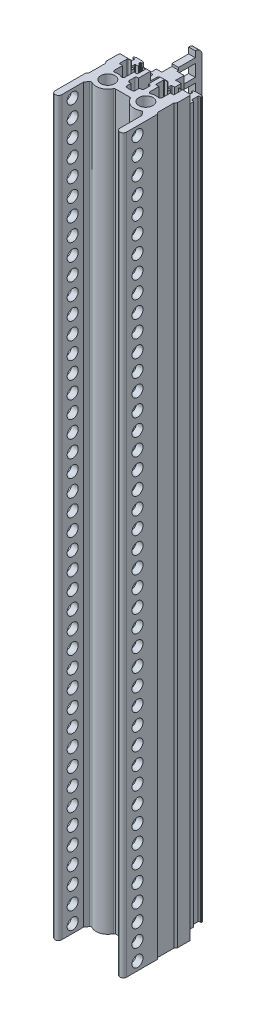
SolidWorks part; units mm, degrees
ref_plane "前视基准面" through (0, 0, 0) normal (0, 0, 1) x (1, 0, 0)
ref_plane "上视基准面" through (0, 0, 0) normal (0, 1, 0) x (1, 0, 0)
ref_plane "右视基准面" through (0, 0, 0) normal (1, 0, 0) x (0, 0, -1)
sketch "草图1" plane through (0, 0, 0) normal (0, 1, 0) x (1, 0, 0)
  line L0 (-2.825, 13.6) -> (-3.725, 13.6)
  line L1 (-8.025, 13.6) -> (-8.025, 11.3)
  line L2 (-3.725, 11.3) -> (-2.825, 11.3)
  line L3 (-3.725, 7.5298) -> (-3.725, 11.3)
  line L4 (-7.125, 11.3) -> (-7.125, 7.8763)
  line L5 (-8.025, 11.3) -> (-7.125, 11.3)
  line L6 (-2.825, 13.6) -> (-2.825, 11.3)
  line L7 (-7.125, 13.6) -> (-8.025, 13.6)
  line L8 (-7.125, 14.6) -> (-7.125, 13.6)
  line L9 (-8.025, 14.6) -> (-7.125, 14.6)
  line L10 (-8.025, 15.8) -> (-8.025, 14.6)
  line L11 (-7.125, 15.8) -> (-8.025, 15.8)
  line L12 (-5.675, 5.25) -> (5.675, 5.25) construction
  line L13 (0, 5.25) -> (0, 10.7319) construction
  line L15 (-10.275, 14.8) -> (-10.275, 13.75)
  line L16 (-9.525, 16.95) -> (-9.525, 15.2)
  line L17 (-10.275, 12.95) -> (-10.375, 12.95) construction
  line L18 (-10.675, 12.65) -> (-10.375, 12.95) construction
  line L19 (-10.675, 9.65) -> (-10.675, 12.65)
  line L20 (-10.2249, 9.1498) -> (-10.675, 9.65)
  line L21 (-10.2249, 9.1498) -> (-10.2251, 4.1498)
  line L22 (-10.675, 3.65) -> (-10.2251, 4.1498)
  line L23 (-10.675, -5.5) -> (-10.675, 3.65)
  line L24 (-8.675, -4.1) -> (-8.675, 0)
  line L25 (-0.675, 20.25) -> (-0.675, 17.75)
  line L26 (-2.075, 20.25) -> (-0.675, 20.25)
  line L27 (-2.075, 17.75) -> (-2.075, 20.25)
  line L28 (-3.725, 17.75) -> (-2.075, 17.75)
  line L29 (-3.725, 15.8) -> (-3.725, 17.75)
  line L30 (-2.825, 15.8) -> (-3.725, 15.8)
  line L31 (-2.825, 14.6) -> (-2.825, 15.8)
  line L32 (-3.725, 14.6) -> (-2.825, 14.6)
  line L33 (-3.725, 13.6) -> (-3.725, 14.6)
  line L34 (-10.675, -5.5) -> (-10.675, 3.65)
  line L35 (-8.675, -5.5) -> (-8.675, 0)
  line L36 (-0.675, 20.25) -> (-0.675, 17.75)
  line L37 (0.675, 20.25) -> (0.675, 17.75)
  line L38 (-2.075, 20.25) -> (-0.675, 20.25)
  line L39 (-2.075, 17.75) -> (-2.075, 20.25)
  line L40 (-3.725, 17.75) -> (-2.075, 17.75)
  line L41 (-3.725, 15.8) -> (-3.725, 17.75)
  line L42 (-2.825, 15.8) -> (-3.725, 15.8)
  line L43 (-2.825, 14.6) -> (-2.825, 15.8)
  line L44 (-3.725, 14.6) -> (-2.825, 14.6)
  line L45 (-3.725, 13.6) -> (-3.725, 14.6)
  line L46 (-2.825, 13.6) -> (-3.725, 13.6)
  line L47 (2.825, 13.6) -> (2.825, 11.3)
  line L48 (-3.725, 11.3) -> (-2.825, 11.3)
  line L49 (-3.725, 7.5298) -> (-3.725, 11.3)
  line L50 (-7.125, 11.3) -> (-7.125, 7.8763)
  line L51 (-8.025, 11.3) -> (-7.125, 11.3)
  line L52 (2.825, 11.3) -> (2.8554, 11.3157)
  line L53 (-7.125, 13.6) -> (-8.025, 13.6)
  line L54 (-7.125, 14.6) -> (-7.125, 13.6)
  line L55 (-8.025, 14.6) -> (-7.125, 14.6)
  line L56 (-8.025, 15.8) -> (-8.025, 14.6)
  line L57 (-7.125, 15.8) -> (-8.025, 15.8)
  line L58 (-10.275, 13.75) -> (-10.375, 13.75)
  line L59 (-9.725, 15) -> (-10.075, 15)
  line L60 (-7.875, 17.75) -> (-9.675, 17.75)
  line L61 (-9.675, 17.75) -> (-9.7164, 17.7086)
  line L62 (-10.225, 17.45) -> (-10.225, 17.35)
  line L63 (-10.275, 12.95) -> (-10.375, 12.95) construction
  line L64 (-10.675, 12.65) -> (-10.375, 12.95) construction
  line L65 (-10.675, 9.65) -> (-10.675, 12.65)
  line L66 (-10.2249, 9.1498) -> (-10.675, 9.65)
  line L67 (-10.2249, 9.1498) -> (-10.2251, 4.1498)
  line L68 (-10.2251, 4.1498) -> (-10.2251, 6.4588)
  line L69 (2.825, 13.6) -> (3.725, 13.6)
  line L70 (8.025, 13.6) -> (8.025, 11.3)
  line L71 (3.725, 11.3) -> (2.825, 11.3)
  line L72 (3.725, 7.5298) -> (3.725, 11.3)
  line L73 (7.125, 11.3) -> (7.125, 7.8763)
  line L74 (8.025, 11.3) -> (7.125, 11.3)
  line L75 (-10.025, 17.15) -> (-9.725, 17.15)
  line L76 (7.125, 13.6) -> (8.025, 13.6)
  line L77 (7.125, 14.6) -> (7.125, 13.6)
  line L78 (8.025, 14.6) -> (7.125, 14.6)
  line L79 (8.025, 15.8) -> (8.025, 14.6)
  line L80 (7.125, 15.8) -> (8.025, 15.8)
  line L81 (-9.8578, 17.65) -> (-10.025, 17.65)
  line L82 (-7.8336, 17.7086) -> (-7.875, 17.75)
  line L83 (-7.325, 17.35) -> (-7.325, 17.45)
  line L85 (7.125, 15.8) -> (7.125, 15.8672)
  line L86 (10.275, 12.95) -> (10.375, 12.95) construction
  line L87 (10.675, 12.65) -> (10.375, 12.95) construction
  line L88 (10.675, 9.65) -> (10.675, 12.65)
  line L89 (10.2249, 9.1498) -> (10.675, 9.65)
  line L90 (10.2249, 9.1498) -> (10.2251, 4.1498)
  line L91 (10.675, 3.65) -> (10.2251, 4.1498)
  line L92 (10.675, -5.5) -> (10.675, 3.65)
  line L93 (8.675, -4.1) -> (8.675, 0)
  line L94 (0.675, 20.25) -> (0.675, 17.75)
  line L95 (2.075, 20.25) -> (0.675, 20.25)
  line L96 (2.075, 17.75) -> (2.075, 20.25)
  line L97 (3.725, 17.75) -> (2.075, 17.75)
  line L98 (3.725, 15.8) -> (3.725, 17.75)
  line L99 (2.825, 15.8) -> (3.725, 15.8)
  line L100 (2.825, 14.6) -> (2.825, 15.8)
  line L101 (3.725, 14.6) -> (2.825, 14.6)
  line L102 (3.725, 13.6) -> (3.725, 14.6)
  line L103 (10.675, -5.5) -> (10.675, 3.65)
  line L104 (8.675, -5.5) -> (8.675, 0)
  line L105 (8.675, 0) -> (-8.675, 0)
  line L106 (0.675, 20.25) -> (0.675, 17.75)
  line L107 (2.075, 20.25) -> (0.675, 20.25)
  line L108 (2.075, 17.75) -> (2.075, 20.25)
  line L109 (3.725, 17.75) -> (2.075, 17.75)
  line L110 (3.725, 15.8) -> (3.725, 17.75)
  line L111 (2.825, 15.8) -> (3.725, 15.8)
  line L112 (2.825, 14.6) -> (2.825, 15.8)
  line L113 (3.725, 14.6) -> (2.825, 14.6)
  line L114 (3.725, 13.6) -> (3.725, 14.6)
  line L115 (2.825, 13.6) -> (3.725, 13.6)
  line L116 (7.1836, 16.0086) -> (7.7664, 16.5914)
  line L117 (3.725, 11.3) -> (2.825, 11.3)
  line L118 (3.725, 7.5298) -> (3.725, 11.3)
  line L119 (7.125, 11.3) -> (7.125, 7.8763)
  line L120 (8.025, 11.3) -> (7.125, 11.3)
  line L121 (7.825, 16.7328) -> (7.825, 16.95)
  line L122 (7.125, 13.6) -> (8.025, 13.6)
  line L123 (7.125, 14.6) -> (7.125, 13.6)
  line L124 (8.025, 14.6) -> (7.125, 14.6)
  line L125 (8.025, 15.8) -> (8.025, 14.6)
  line L126 (7.125, 15.8) -> (8.025, 15.8)
  line L127 (7.625, 17.15) -> (7.525, 17.15)
  line L128 (7.325, 17.35) -> (7.325, 17.45)
  line L129 (7.525, 17.65) -> (7.6922, 17.65)
  line L130 (7.8336, 17.7086) -> (7.875, 17.75)
  line L131 (9.725, 15) -> (10.075, 15)
  line L132 (10.275, 12.95) -> (10.375, 12.95) construction
  line L133 (10.675, 12.65) -> (10.375, 12.95) construction
  line L134 (10.675, 9.65) -> (10.675, 12.65)
  line L135 (10.2249, 9.1498) -> (10.675, 9.65)
  line L136 (10.2249, 9.1498) -> (10.2251, 4.1498)
  line L137 (10.2251, 4.1498) -> (10.2251, 6.4588)
  line L138 (-0.675, 17.75) -> (0.675, 17.75)
  line L139 (-7.125, 16.775) -> (-3.725, 16.775) construction
  line L140 (-5.425, 16.775) -> (-5.425, 11.3) construction
  line L141 (3.725, 16.775) -> (7.125, 16.775) construction
  line L142 (5.425, 16.775) -> (5.425, 12.65) construction
  line L143 (9.8578, 17.65) -> (10.025, 17.65)
  line L144 (10.025, 17.15) -> (9.725, 17.15)
  line L145 (10.225, 17.45) -> (10.225, 17.35)
  line L146 (9.675, 17.75) -> (9.7164, 17.7086)
  line L147 (9.525, 16.95) -> (9.525, 15.2)
  line L148 (7.875, 17.75) -> (9.675, 17.75)
  line L149 (10.275, 14.8) -> (10.275, 13.75)
  line L150 (-7.825, 16.7328) -> (-7.825, 16.95)
  line L151 (-7.125, 15.8) -> (-7.125, 15.8672)
  line L152 (-7.525, 17.65) -> (-7.6922, 17.65)
  line L153 (-7.625, 17.15) -> (-7.525, 17.15)
  line L154 (-7.1836, 16.0086) -> (-7.7664, 16.5914)
  line L155 (-10.375, 13.75) -> (-10.675, 13.45)
  line L156 (-10.675, 13.45) -> (-10.675, 12.65)
  line L157 (10.675, 13.45) -> (10.675, 12.65)
  line L158 (10.375, 13.75) -> (10.675, 13.45)
  line L159 (10.275, 13.75) -> (10.375, 13.75)
  arc A1 (-10.675, -5.5) -> (-8.675, -5.5) centre (-9.675, -5.5) ccw
  arc A2 (-10.675, -5.5) -> (-8.675, -5.5) centre (-9.675, -5.5) ccw
  circle A4 centre (-5.675, 5.25) radius 1.6
  arc A6 (8.675, -5.5) -> (10.675, -5.5) centre (9.675, -5.5) ccw
  arc A7 (8.675, -5.5) -> (10.675, -5.5) centre (9.675, -5.5) ccw
  circle A9 centre (5.675, 5.25) radius 1.6
  arc A10 (7.1836, 16.0086) -> (7.125, 15.8672) centre (7.325, 15.8672) ccw
  arc A11 (7.7664, 16.5914) -> (7.825, 16.7328) centre (7.625, 16.7328) ccw
  arc A12 (7.825, 16.95) -> (7.625, 17.15) centre (7.625, 16.95) ccw
  arc A13 (7.325, 17.35) -> (7.525, 17.15) centre (7.525, 17.35) ccw
  arc A14 (7.525, 17.65) -> (7.325, 17.45) centre (7.525, 17.45) ccw
  arc A15 (10.275, 14.8) -> (10.075, 15) centre (10.075, 14.8) ccw
  arc A16 (10.225, 17.45) -> (10.025, 17.65) centre (10.025, 17.45) ccw
  arc A17 (9.725, 17.15) -> (9.525, 16.95) centre (9.725, 16.95) ccw
  arc A18 (10.025, 17.15) -> (10.225, 17.35) centre (10.025, 17.35) ccw
  arc A19 (9.7164, 17.7086) -> (9.8578, 17.65) centre (9.8578, 17.85) ccw
  arc A20 (9.525, 15.2) -> (9.725, 15) centre (9.725, 15.2) ccw
  arc A21 (7.6922, 17.65) -> (7.8336, 17.7086) centre (7.6922, 17.85) ccw
  arc A22 (-9.525, 15.2) -> (-9.725, 15) centre (-9.725, 15.2) cw
  arc A23 (-10.275, 14.8) -> (-10.075, 15) centre (-10.075, 14.8) cw
  arc A24 (-9.7164, 17.7086) -> (-9.8578, 17.65) centre (-9.8578, 17.85) cw
  arc A25 (-10.025, 17.15) -> (-10.225, 17.35) centre (-10.025, 17.35) cw
  arc A26 (-9.725, 17.15) -> (-9.525, 16.95) centre (-9.725, 16.95) cw
  arc A27 (-10.225, 17.45) -> (-10.025, 17.65) centre (-10.025, 17.45) cw
  arc A28 (-7.7664, 16.5914) -> (-7.825, 16.7328) centre (-7.625, 16.7328) cw
  arc A29 (-7.1836, 16.0086) -> (-7.125, 15.8672) centre (-7.325, 15.8672) cw
  arc A30 (-7.6922, 17.65) -> (-7.8336, 17.7086) centre (-7.6922, 17.85) cw
  arc A31 (-7.525, 17.65) -> (-7.325, 17.45) centre (-7.525, 17.45) cw
  arc A32 (-7.325, 17.35) -> (-7.525, 17.15) centre (-7.525, 17.35) cw
  arc A33 (-7.825, 16.95) -> (-7.625, 17.15) centre (-7.625, 16.95) cw
  arc A34 (-3.725, 7.5298) -> (-7.125, 7.8763) centre (-5.675, 5.25) ccw
  arc A35 (7.125, 7.8763) -> (3.725, 7.5298) centre (5.675, 5.25) ccw
  dimension "D4" = 11.35
  dimension "D5" = 3.2
  dimension "D6" = 6
  dimension "D7" = 0.1
  dimension "D1" = 5.2
  dimension "D2" = 5.2
  dimension "D3" = 15
  dimension "D8" = 0.8
extrude "凸台-拉伸1" add sketch "草图1" along normal mid plane 218.44
sketch "草图4" plane through (0, 109.22, 0) normal (0, 1, 0) x (1, 0, 0)
  line L1 (-2.075, 17.75) -> (-0.075, 17.75)
  line L2 (-2.075, 17.75) -> (-2.075, 27.75)
  line L3 (-2.075, 27.75) -> (-0.075, 27.75)
  line L4 (-0.075, 17.75) -> (-0.075, 27.75)
  dimension "D1" = 2
  dimension "D2" = 10
extrude "凸台-拉伸2" add sketch "草图4" against normal up to surface (218.44 mm away)
sketch "草图17" plane through (0, 109.22, 0) normal (0, 1, 0) x (1, 0, 0)
  line L0 (7.125, 13.6) -> (8.025, 13.6) construction
  line L1 (8.125, 13.6) -> (2.725, 13.6)
  line L2 (8.125, 13.6) -> (8.125, 11.1)
  line L3 (8.125, 11.1) -> (2.725, 11.1)
  line L4 (2.725, 13.6) -> (2.725, 11.1)
  line L5 (7.125, 15.8) -> (8.025, 15.8) construction
  line L6 (8.125, 15.8) -> (2.725, 15.8)
  line L7 (8.125, 15.8) -> (8.125, 14.6)
  line L8 (8.125, 14.6) -> (2.725, 14.6)
  line L9 (2.725, 15.8) -> (2.725, 14.6)
  line L10 (3.725, 14.6) -> (2.825, 14.6) construction
  line L11 (-2.825, 15.8) -> (-3.725, 15.8) construction
  line L12 (-2.725, 15.8) -> (-8.125, 15.8)
  line L13 (-2.725, 15.8) -> (-2.725, 14.6)
  line L14 (-2.725, 14.6) -> (-8.125, 14.6)
  line L15 (-8.125, 15.8) -> (-8.125, 14.6)
  line L16 (-8.025, 14.6) -> (-7.125, 14.6) construction
  line L17 (-2.825, 13.6) -> (-3.725, 13.6) construction
  line L18 (-2.725, 13.6) -> (-8.125, 13.6)
  line L19 (-2.725, 13.6) -> (-2.725, 11.1)
  line L20 (-2.725, 11.1) -> (-8.125, 11.1)
  line L21 (-8.125, 13.6) -> (-8.125, 11.1)
  line L22 (8.025, 13.6) -> (8.025, 11.3) construction
  line L23 (2.825, 13.6) -> (2.825, 11.3) construction
  line L24 (3.725, 11.3) -> (2.825, 11.3) construction
  line L25 (-2.825, 13.6) -> (-2.825, 11.3) construction
  line L26 (-8.025, 13.6) -> (-8.025, 11.3) construction
  dimension "D1" = 0.1
  dimension "D2" = 0.1
  dimension "D3" = 0.2
  dimension "D4" = 0.1
  dimension "D5" = 0.1
extrude "切除-拉伸10" cut sketch "草图17" against normal through all
fillet "圆角4" radius 0.2 16 edges at (8.125, 0, -11.1) (8.125, 0, -14.6) (8.125, 0, -13.6) (8.125, 0, -15.8) (2.725, 0, -15.8) (2.725, 0, -13.6) (2.725, 0, -11.1) (2.725, 0, -14.6) (-8.125, 0, -11.1) (-8.125, 0, -14.6) (-8.125, 0, -13.6) (-8.125, 0, -15.8) (-2.725, 0, -11.1) (-2.725, 0, -14.6) (-2.725, 0, -13.6) (-2.725, 0, -15.8)
sketch "草图14" plane through (0, 109.22, 0) normal (0, 1, 0) x (1, 0, 0)
  line L0 (-0.075, 17.75) -> (-0.575, 17.75)
  line L1 (-0.575, 17.75) -> (-0.575, 19.25)
  line L2 (-0.575, 19.25) -> (-0.075, 19.75)
  line L3 (-0.075, 17.75) -> (-0.075, 27.75) construction
  line L4 (-0.075, 19.75) -> (-0.075, 17.75)
  line L5 (0.675, 20.25) -> (1.675, 20.25)
  line L6 (2.075, 20.25) -> (0.675, 20.25) construction
  line L7 (1.675, 20.25) -> (0.675, 19.25)
  line L8 (0.675, 20.25) -> (0.675, 17.75) construction
  line L9 (0.675, 19.25) -> (0.675, 20.25)
  dimension "D1" = 45
  dimension "D2" = 0.5
  dimension "D3" = 0.5
  dimension "D4" = 1
  dimension "D5" = 1
extrude "切除-拉伸7" cut sketch "草图14" against normal through all
sketch "草图19" plane through (0, 109.22, 0) normal (0, 1, 0) x (1, 0, 0)
  line L1 (2.075, 20.25) -> (-0.575, 20.25)
  line L2 (2.075, 20.25) -> (2.075, 17.75)
  line L3 (2.075, 17.75) -> (-0.575, 17.75)
  line L4 (-0.575, 20.25) -> (-0.575, 17.75)
extrude "凸台-拉伸3" add sketch "草图19" against normal up to surface (218.44 mm away)
sketch "草图6" plane through (0, -109.22, 0) normal (0, -1, 0) x (-1, 0, 0)
  line L0 (0, 0) -> (0, 12.9416) construction
  line L1 (8.675, 0) -> (8.675, 1)
  line L2 (-7.6934, 2.3906) -> (-8.675, 1)
  line L3 (7.6934, 2.3906) -> (8.675, 1)
  line L4 (-8.675, 0) -> (-8.675, 1)
  line L5 (-3.725, 17.75) -> (-2.075, 17.75) construction
  line L7 (2.25, 7.75) -> (2.25, 10.25)
  line L8 (8.675, 0) -> (-8.675, 0)
  line L9 (8.675, -5.5) -> (8.675, 0) construction
  line L10 (-2.4058, 4) -> (2.4058, 4)
  line L11 (2.25, 10.25) -> (1.5, 10.25)
  line L12 (1.5, 10.25) -> (1.5, 16.25)
  line L13 (-1.5, 10.25) -> (-1.5, 16.25)
  line L14 (-2.25, 10.25) -> (-1.5, 10.25)
  line L15 (-2.25, 7.75) -> (-2.25, 10.25)
  line L16 (2.25, 7.75) -> (1.25, 7.75)
  line L17 (1.25, 7.75) -> (1.25, 6)
  line L18 (-1.25, 7.75) -> (-1.25, 6)
  line L19 (-2.25, 7.75) -> (-1.25, 7.75)
  line L20 (1.25, 6) -> (-1.25, 6)
  line L21 (1.5, 16.25) -> (-1.5, 16.25)
  arc A0 (2.4058, 4) -> (7.6934, 2.3906) centre (5.675, 5.25) ccw
  arc A1 (-2.4058, 4) -> (-7.6934, 2.3906) centre (-5.675, 5.25) cw
  dimension "D1" = 7
  dimension "D3" = 4
  dimension "D2" = 1
  dimension "D4" = 1.5
  dimension "D6" = 2
  dimension "D7" = 2.5
  dimension "D8" = 3
  dimension "D9" = 4.5
  dimension "D10" = 6
  dimension "D11" = 2.5
extrude "切除-拉伸4" cut sketch "草图6" against normal through all
sketch "草图2" plane through (10.675, 0, 0) normal (1, 0, 0) x (0, 0, -1)
  line L0 (20.25, 0) -> (52.8609, 0) construction
  line L1 (20.75, 109.22) -> (13.75, 109.22)
  line L2 (20.75, 109.22) -> (20.75, 106.68)
  line L3 (20.75, 106.68) -> (13.75, 106.68)
  line L4 (13.75, 109.22) -> (13.75, 106.68)
  line L5 (20.25, 109.22) -> (20.25, -109.22) construction
  line L6 (13.75, -109.22) -> (13.75, -106.68)
  line L7 (20.75, -106.68) -> (13.75, -106.68)
  line L8 (20.75, -109.22) -> (20.75, -106.68)
  line L9 (20.75, -109.22) -> (13.75, -109.22)
  line L11 (17.75, 109.22) -> (27.75, 109.22) construction
  line L12 (27.75, -109.22) -> (27.75, 109.22) construction
  dimension "D1" = 7
  dimension "D2" = 2.54
  dimension "D3" = 7
extrude "切除-拉伸1" cut sketch "草图2" against normal through all
sketch "草图3" plane through (10.675, 0, 0) normal (1, 0, 0) x (0, 0, -1)
  line L0 (-6.5, 109.22) -> (-6.5, -109.22) construction
  line L1 (-5.5, 109.22) -> (3.65, 109.22) construction
  circle A0 centre (-2.25, 106.68) radius 1.65
  circle A1 centre (-2.25, 101.6) radius 1.65
  circle A2 centre (-2.25, 96.52) radius 1.65
  circle A3 centre (-2.25, 91.44) radius 1.65
  circle A4 centre (-2.25, 86.36) radius 1.65
  circle A5 centre (-2.25, 81.28) radius 1.65
  circle A6 centre (-2.25, 76.2) radius 1.65
  circle A7 centre (-2.25, 71.12) radius 1.65
  circle A8 centre (-2.25, 66.04) radius 1.65
  circle A9 centre (-2.25, 60.96) radius 1.65
  circle A10 centre (-2.25, 55.88) radius 1.65
  circle A11 centre (-2.25, 50.8) radius 1.65
  circle A12 centre (-2.25, 45.72) radius 1.65
  circle A13 centre (-2.25, 40.64) radius 1.65
  circle A14 centre (-2.25, 35.56) radius 1.65
  circle A15 centre (-2.25, 30.48) radius 1.65
  circle A16 centre (-2.25, 25.4) radius 1.65
  circle A17 centre (-2.25, 20.32) radius 1.65
  circle A18 centre (-2.25, 15.24) radius 1.65
  circle A19 centre (-2.25, 10.16) radius 1.65
  circle A20 centre (-2.25, 5.08) radius 1.65
  circle A21 centre (-2.25, 0) radius 1.65
  circle A22 centre (-2.25, -5.08) radius 1.65
  circle A23 centre (-2.25, -10.16) radius 1.65
  circle A24 centre (-2.25, -15.24) radius 1.65
  circle A25 centre (-2.25, -20.32) radius 1.65
  circle A26 centre (-2.25, -25.4) radius 1.65
  circle A27 centre (-2.25, -30.48) radius 1.65
  circle A28 centre (-2.25, -35.56) radius 1.65
  circle A29 centre (-2.25, -40.64) radius 1.65
  circle A30 centre (-2.25, -45.72) radius 1.65
  circle A31 centre (-2.25, -50.8) radius 1.65
  circle A32 centre (-2.25, -55.88) radius 1.65
  circle A33 centre (-2.25, -60.96) radius 1.65
  circle A34 centre (-2.25, -66.04) radius 1.65
  circle A35 centre (-2.25, -71.12) radius 1.65
  circle A36 centre (-2.25, -76.2) radius 1.65
  circle A37 centre (-2.25, -81.28) radius 1.65
  circle A38 centre (-2.25, -86.36) radius 1.65
  circle A39 centre (-2.25, -91.44) radius 1.65
  circle A40 centre (-2.25, -96.52) radius 1.65
  circle A41 centre (-2.25, -101.6) radius 1.65
  circle A42 centre (-2.25, -106.68) radius 1.65
  circle A43 centre (-2.25, -111.76) radius 1.65
  circle A44 centre (-2.25, -116.84) radius 1.65
  circle A45 centre (-2.25, -121.92) radius 1.65
  circle A46 centre (-2.25, -127) radius 1.65
  circle A47 centre (-2.25, -132.08) radius 1.65
  circle A48 centre (-2.25, -137.16) radius 1.65
  circle A49 centre (-2.25, -142.24) radius 1.65
  circle A50 centre (-2.25, -147.32) radius 1.65
  circle A51 centre (-2.25, -152.4) radius 1.65
  circle A52 centre (-2.25, -157.48) radius 1.65
  circle A53 centre (-2.25, -162.56) radius 1.65
  circle A54 centre (-2.25, -167.64) radius 1.65
  circle A55 centre (-2.25, -172.72) radius 1.65
  circle A56 centre (-2.25, -177.8) radius 1.65
  circle A57 centre (-2.25, -182.88) radius 1.65
  circle A58 centre (-2.25, -187.96) radius 1.65
  circle A59 centre (-2.25, -193.04) radius 1.65
  circle A60 centre (-2.25, -198.12) radius 1.65
  circle A61 centre (-2.25, -203.2) radius 1.65
  circle A62 centre (-2.25, -208.28) radius 1.65
  circle A63 centre (-2.25, -213.36) radius 1.65
  circle A64 centre (-2.25, -218.44) radius 1.65
  circle A65 centre (-2.25, -223.52) radius 1.65
  circle A66 centre (-2.25, -228.6) radius 1.65
  circle A67 centre (-2.25, -233.68) radius 1.65
  circle A68 centre (-2.25, -238.76) radius 1.65
  circle A69 centre (-2.25, -243.84) radius 1.65
  circle A70 centre (-2.25, -248.92) radius 1.65
  circle A71 centre (-2.25, -254) radius 1.65
  circle A72 centre (-2.25, -259.08) radius 1.65
  circle A73 centre (-2.25, -264.16) radius 1.65
  circle A74 centre (-2.25, -269.24) radius 1.65
  circle A75 centre (-2.25, -274.32) radius 1.65
  circle A76 centre (-2.25, -279.4) radius 1.65
  circle A77 centre (-2.25, -284.48) radius 1.65
  circle A78 centre (-2.25, -289.56) radius 1.65
  circle A79 centre (-2.25, -294.64) radius 1.65
  circle A80 centre (-2.25, -299.72) radius 1.65
  circle A81 centre (-2.25, -304.8) radius 1.65
  circle A82 centre (-2.25, -309.88) radius 1.65
  circle A83 centre (-2.25, -314.96) radius 1.65
  circle A84 centre (-2.25, -320.04) radius 1.65
  dimension "D1" = 4.25
  dimension "D3" = 3.3
  dimension "D2" = 2.54
  dimension "D4" = 85
extrude "切除-拉伸2" cut sketch "草图3" against normal through all
sketch "草图5" plane through (-2.075, 0, 0) normal (-1, 0, 0) x (0, 0, 1)
  line L0 (-27.75, -109.22) -> (-27.75, 109.22) construction
  line L1 (-25.75, -102.34) -> (-20.25, -102.34)
  line L2 (-25.75, -102.34) -> (-25.75, -105.94)
  line L3 (-25.75, -105.94) -> (-20.25, -105.94)
  line L4 (-20.25, -102.34) -> (-20.25, -105.94)
  line L5 (-20.75, -109.22) -> (-27.75, -109.22) construction
  line L6 (-25.75, -97.26) -> (-20.25, -97.26)
  line L7 (-25.75, -97.26) -> (-25.75, -100.86)
  line L8 (-25.75, -100.86) -> (-20.25, -100.86)
  line L9 (-20.25, -97.26) -> (-20.25, -100.86)
  line L10 (-25.75, -92.18) -> (-20.25, -92.18)
  line L11 (-25.75, -92.18) -> (-25.75, -95.78)
  line L12 (-25.75, -95.78) -> (-20.25, -95.78)
  line L13 (-20.25, -92.18) -> (-20.25, -95.78)
  line L14 (-25.75, -87.1) -> (-20.25, -87.1)
  line L15 (-25.75, -87.1) -> (-25.75, -90.7)
  line L16 (-25.75, -90.7) -> (-20.25, -90.7)
  line L17 (-20.25, -87.1) -> (-20.25, -90.7)
  line L18 (-25.75, -82.02) -> (-20.25, -82.02)
  line L19 (-25.75, -82.02) -> (-25.75, -85.62)
  line L20 (-25.75, -85.62) -> (-20.25, -85.62)
  line L21 (-20.25, -82.02) -> (-20.25, -85.62)
  line L22 (-25.75, -76.94) -> (-20.25, -76.94)
  line L23 (-25.75, -76.94) -> (-25.75, -80.54)
  line L24 (-25.75, -80.54) -> (-20.25, -80.54)
  line L25 (-20.25, -76.94) -> (-20.25, -80.54)
  line L26 (-25.75, -71.86) -> (-20.25, -71.86)
  line L27 (-25.75, -71.86) -> (-25.75, -75.46)
  line L28 (-25.75, -75.46) -> (-20.25, -75.46)
  line L29 (-20.25, -71.86) -> (-20.25, -75.46)
  line L30 (-25.75, -66.78) -> (-20.25, -66.78)
  line L31 (-25.75, -66.78) -> (-25.75, -70.38)
  line L32 (-25.75, -70.38) -> (-20.25, -70.38)
  line L33 (-20.25, -66.78) -> (-20.25, -70.38)
  line L34 (-25.75, -61.7) -> (-20.25, -61.7)
  line L35 (-25.75, -61.7) -> (-25.75, -65.3)
  line L36 (-25.75, -65.3) -> (-20.25, -65.3)
  line L37 (-20.25, -61.7) -> (-20.25, -65.3)
  line L38 (-25.75, -56.62) -> (-20.25, -56.62)
  line L39 (-25.75, -56.62) -> (-25.75, -60.22)
  line L40 (-25.75, -60.22) -> (-20.25, -60.22)
  line L41 (-20.25, -56.62) -> (-20.25, -60.22)
  line L42 (-25.75, -51.54) -> (-20.25, -51.54)
  line L43 (-25.75, -51.54) -> (-25.75, -55.14)
  line L44 (-25.75, -55.14) -> (-20.25, -55.14)
  line L45 (-20.25, -51.54) -> (-20.25, -55.14)
  line L46 (-25.75, -46.46) -> (-20.25, -46.46)
  line L47 (-25.75, -46.46) -> (-25.75, -50.06)
  line L48 (-25.75, -50.06) -> (-20.25, -50.06)
  line L49 (-20.25, -46.46) -> (-20.25, -50.06)
  line L50 (-25.75, -41.38) -> (-20.25, -41.38)
  line L51 (-25.75, -41.38) -> (-25.75, -44.98)
  line L52 (-25.75, -44.98) -> (-20.25, -44.98)
  line L53 (-20.25, -41.38) -> (-20.25, -44.98)
  line L54 (-25.75, -36.3) -> (-20.25, -36.3)
  line L55 (-25.75, -36.3) -> (-25.75, -39.9)
  line L56 (-25.75, -39.9) -> (-20.25, -39.9)
  line L57 (-20.25, -36.3) -> (-20.25, -39.9)
  line L58 (-25.75, -31.22) -> (-20.25, -31.22)
  line L59 (-25.75, -31.22) -> (-25.75, -34.82)
  line L60 (-25.75, -34.82) -> (-20.25, -34.82)
  line L61 (-20.25, -31.22) -> (-20.25, -34.82)
  line L62 (-25.75, -26.14) -> (-20.25, -26.14)
  line L63 (-25.75, -26.14) -> (-25.75, -29.74)
  line L64 (-25.75, -29.74) -> (-20.25, -29.74)
  line L65 (-20.25, -26.14) -> (-20.25, -29.74)
  line L66 (-25.75, -21.06) -> (-20.25, -21.06)
  line L67 (-25.75, -21.06) -> (-25.75, -24.66)
  line L68 (-25.75, -24.66) -> (-20.25, -24.66)
  line L69 (-20.25, -21.06) -> (-20.25, -24.66)
  line L70 (-25.75, -15.98) -> (-20.25, -15.98)
  line L71 (-25.75, -15.98) -> (-25.75, -19.58)
  line L72 (-25.75, -19.58) -> (-20.25, -19.58)
  line L73 (-20.25, -15.98) -> (-20.25, -19.58)
  line L74 (-25.75, -10.9) -> (-20.25, -10.9)
  line L75 (-25.75, -10.9) -> (-25.75, -14.5)
  line L76 (-25.75, -14.5) -> (-20.25, -14.5)
  line L77 (-20.25, -10.9) -> (-20.25, -14.5)
  line L78 (-25.75, -5.82) -> (-20.25, -5.82)
  line L79 (-25.75, -5.82) -> (-25.75, -9.42)
  line L80 (-25.75, -9.42) -> (-20.25, -9.42)
  line L81 (-20.25, -5.82) -> (-20.25, -9.42)
  line L82 (-25.75, -0.74) -> (-20.25, -0.74)
  line L83 (-25.75, -0.74) -> (-25.75, -4.34)
  line L84 (-25.75, -4.34) -> (-20.25, -4.34)
  line L85 (-20.25, -0.74) -> (-20.25, -4.34)
  line L86 (-25.75, 4.34) -> (-20.25, 4.34)
  line L87 (-25.75, 4.34) -> (-25.75, 0.74)
  line L88 (-25.75, 0.74) -> (-20.25, 0.74)
  line L89 (-20.25, 4.34) -> (-20.25, 0.74)
  line L90 (-25.75, 9.42) -> (-20.25, 9.42)
  line L91 (-25.75, 9.42) -> (-25.75, 5.82)
  line L92 (-25.75, 5.82) -> (-20.25, 5.82)
  line L93 (-20.25, 9.42) -> (-20.25, 5.82)
  line L94 (-25.75, 14.5) -> (-20.25, 14.5)
  line L95 (-25.75, 14.5) -> (-25.75, 10.9)
  line L96 (-25.75, 10.9) -> (-20.25, 10.9)
  line L97 (-20.25, 14.5) -> (-20.25, 10.9)
  line L98 (-25.75, 19.58) -> (-20.25, 19.58)
  line L99 (-25.75, 19.58) -> (-25.75, 15.98)
  line L100 (-25.75, 15.98) -> (-20.25, 15.98)
  line L101 (-20.25, 19.58) -> (-20.25, 15.98)
  line L102 (-25.75, 24.66) -> (-20.25, 24.66)
  line L103 (-25.75, 24.66) -> (-25.75, 21.06)
  line L104 (-25.75, 21.06) -> (-20.25, 21.06)
  line L105 (-20.25, 24.66) -> (-20.25, 21.06)
  line L106 (-25.75, 29.74) -> (-20.25, 29.74)
  line L107 (-25.75, 29.74) -> (-25.75, 26.14)
  line L108 (-25.75, 26.14) -> (-20.25, 26.14)
  line L109 (-20.25, 29.74) -> (-20.25, 26.14)
  line L110 (-25.75, 34.82) -> (-20.25, 34.82)
  line L111 (-25.75, 34.82) -> (-25.75, 31.22)
  line L112 (-25.75, 31.22) -> (-20.25, 31.22)
  line L113 (-20.25, 34.82) -> (-20.25, 31.22)
  line L114 (-25.75, 39.9) -> (-20.25, 39.9)
  line L115 (-25.75, 39.9) -> (-25.75, 36.3)
  line L116 (-25.75, 36.3) -> (-20.25, 36.3)
  line L117 (-20.25, 39.9) -> (-20.25, 36.3)
  line L118 (-25.75, 44.98) -> (-20.25, 44.98)
  line L119 (-25.75, 44.98) -> (-25.75, 41.38)
  line L120 (-25.75, 41.38) -> (-20.25, 41.38)
  line L121 (-20.25, 44.98) -> (-20.25, 41.38)
  line L122 (-25.75, 50.06) -> (-20.25, 50.06)
  line L123 (-25.75, 50.06) -> (-25.75, 46.46)
  line L124 (-25.75, 46.46) -> (-20.25, 46.46)
  line L125 (-20.25, 50.06) -> (-20.25, 46.46)
  line L126 (-25.75, 55.14) -> (-20.25, 55.14)
  line L127 (-25.75, 55.14) -> (-25.75, 51.54)
  line L128 (-25.75, 51.54) -> (-20.25, 51.54)
  line L129 (-20.25, 55.14) -> (-20.25, 51.54)
  line L130 (-25.75, 60.22) -> (-20.25, 60.22)
  line L131 (-25.75, 60.22) -> (-25.75, 56.62)
  line L132 (-25.75, 56.62) -> (-20.25, 56.62)
  line L133 (-20.25, 60.22) -> (-20.25, 56.62)
  line L134 (-25.75, 65.3) -> (-20.25, 65.3)
  line L135 (-25.75, 65.3) -> (-25.75, 61.7)
  line L136 (-25.75, 61.7) -> (-20.25, 61.7)
  line L137 (-20.25, 65.3) -> (-20.25, 61.7)
  line L138 (-25.75, 70.38) -> (-20.25, 70.38)
  line L139 (-25.75, 70.38) -> (-25.75, 66.78)
  line L140 (-25.75, 66.78) -> (-20.25, 66.78)
  line L141 (-20.25, 70.38) -> (-20.25, 66.78)
  line L142 (-25.75, 75.46) -> (-20.25, 75.46)
  line L143 (-25.75, 75.46) -> (-25.75, 71.86)
  line L144 (-25.75, 71.86) -> (-20.25, 71.86)
  line L145 (-20.25, 75.46) -> (-20.25, 71.86)
  line L146 (-25.75, 80.54) -> (-20.25, 80.54)
  line L147 (-25.75, 80.54) -> (-25.75, 76.94)
  line L148 (-25.75, 76.94) -> (-20.25, 76.94)
  line L149 (-20.25, 80.54) -> (-20.25, 76.94)
  line L150 (-25.75, 85.62) -> (-20.25, 85.62)
  line L151 (-25.75, 85.62) -> (-25.75, 82.02)
  line L152 (-25.75, 82.02) -> (-20.25, 82.02)
  line L153 (-20.25, 85.62) -> (-20.25, 82.02)
  line L154 (-25.75, 90.7) -> (-20.25, 90.7)
  line L155 (-25.75, 90.7) -> (-25.75, 87.1)
  line L156 (-25.75, 87.1) -> (-20.25, 87.1)
  line L157 (-20.25, 90.7) -> (-20.25, 87.1)
  line L158 (-25.75, 95.78) -> (-20.25, 95.78)
  line L159 (-25.75, 95.78) -> (-25.75, 92.18)
  line L160 (-25.75, 92.18) -> (-20.25, 92.18)
  line L161 (-20.25, 95.78) -> (-20.25, 92.18)
  line L162 (-25.75, 100.86) -> (-20.25, 100.86)
  line L163 (-25.75, 100.86) -> (-25.75, 97.26)
  line L164 (-25.75, 97.26) -> (-20.25, 97.26)
  line L165 (-20.25, 100.86) -> (-20.25, 97.26)
  line L166 (-25.75, 105.94) -> (-20.25, 105.94)
  line L167 (-25.75, 105.94) -> (-25.75, 102.34)
  line L168 (-25.75, 102.34) -> (-20.25, 102.34)
  line L169 (-20.25, 105.94) -> (-20.25, 102.34)
  line L170 (-25.75, 111.02) -> (-20.25, 111.02)
  line L171 (-25.75, 111.02) -> (-25.75, 107.42)
  line L172 (-25.75, 107.42) -> (-20.25, 107.42)
  line L173 (-20.25, 111.02) -> (-20.25, 107.42)
  line L174 (-25.75, 116.1) -> (-20.25, 116.1)
  line L175 (-25.75, 116.1) -> (-25.75, 112.5)
  line L176 (-25.75, 112.5) -> (-20.25, 112.5)
  line L177 (-20.25, 116.1) -> (-20.25, 112.5)
  line L178 (-25.75, 121.18) -> (-20.25, 121.18)
  line L179 (-25.75, 121.18) -> (-25.75, 117.58)
  line L180 (-25.75, 117.58) -> (-20.25, 117.58)
  line L181 (-20.25, 121.18) -> (-20.25, 117.58)
  line L182 (-25.75, 126.26) -> (-20.25, 126.26)
  line L183 (-25.75, 126.26) -> (-25.75, 122.66)
  line L184 (-25.75, 122.66) -> (-20.25, 122.66)
  line L185 (-20.25, 126.26) -> (-20.25, 122.66)
  line L186 (-25.75, 131.34) -> (-20.25, 131.34)
  line L187 (-25.75, 131.34) -> (-25.75, 127.74)
  line L188 (-25.75, 127.74) -> (-20.25, 127.74)
  line L189 (-20.25, 131.34) -> (-20.25, 127.74)
  line L190 (-25.75, 136.42) -> (-20.25, 136.42)
  line L191 (-25.75, 136.42) -> (-25.75, 132.82)
  line L192 (-25.75, 132.82) -> (-20.25, 132.82)
  line L193 (-20.25, 136.42) -> (-20.25, 132.82)
  line L194 (-25.75, 141.5) -> (-20.25, 141.5)
  line L195 (-25.75, 141.5) -> (-25.75, 137.9)
  line L196 (-25.75, 137.9) -> (-20.25, 137.9)
  line L197 (-20.25, 141.5) -> (-20.25, 137.9)
  line L198 (-25.75, 146.58) -> (-20.25, 146.58)
  line L199 (-25.75, 146.58) -> (-25.75, 142.98)
  line L200 (-25.75, 142.98) -> (-20.25, 142.98)
  line L201 (-20.25, 146.58) -> (-20.25, 142.98)
  line L202 (-25.75, 151.66) -> (-20.25, 151.66)
  line L203 (-25.75, 151.66) -> (-25.75, 148.06)
  line L204 (-25.75, 148.06) -> (-20.25, 148.06)
  line L205 (-20.25, 151.66) -> (-20.25, 148.06)
  line L206 (-25.75, 156.74) -> (-20.25, 156.74)
  line L207 (-25.75, 156.74) -> (-25.75, 153.14)
  line L208 (-25.75, 153.14) -> (-20.25, 153.14)
  line L209 (-20.25, 156.74) -> (-20.25, 153.14)
  line L210 (-25.75, 161.82) -> (-20.25, 161.82)
  line L211 (-25.75, 161.82) -> (-25.75, 158.22)
  line L212 (-25.75, 158.22) -> (-20.25, 158.22)
  line L213 (-20.25, 161.82) -> (-20.25, 158.22)
  line L214 (-25.75, 166.9) -> (-20.25, 166.9)
  line L215 (-25.75, 166.9) -> (-25.75, 163.3)
  line L216 (-25.75, 163.3) -> (-20.25, 163.3)
  line L217 (-20.25, 166.9) -> (-20.25, 163.3)
  line L218 (-25.75, 171.98) -> (-20.25, 171.98)
  line L219 (-25.75, 171.98) -> (-25.75, 168.38)
  line L220 (-25.75, 168.38) -> (-20.25, 168.38)
  line L221 (-20.25, 171.98) -> (-20.25, 168.38)
  line L222 (-25.75, 177.06) -> (-20.25, 177.06)
  line L223 (-25.75, 177.06) -> (-25.75, 173.46)
  line L224 (-25.75, 173.46) -> (-20.25, 173.46)
  line L225 (-20.25, 177.06) -> (-20.25, 173.46)
  line L226 (-25.75, 182.14) -> (-20.25, 182.14)
  line L227 (-25.75, 182.14) -> (-25.75, 178.54)
  line L228 (-25.75, 178.54) -> (-20.25, 178.54)
  line L229 (-20.25, 182.14) -> (-20.25, 178.54)
  line L230 (-25.75, 187.22) -> (-20.25, 187.22)
  line L231 (-25.75, 187.22) -> (-25.75, 183.62)
  line L232 (-25.75, 183.62) -> (-20.25, 183.62)
  line L233 (-20.25, 187.22) -> (-20.25, 183.62)
  line L234 (-25.75, 192.3) -> (-20.25, 192.3)
  line L235 (-25.75, 192.3) -> (-25.75, 188.7)
  line L236 (-25.75, 188.7) -> (-20.25, 188.7)
  line L237 (-20.25, 192.3) -> (-20.25, 188.7)
  line L238 (-25.75, 197.38) -> (-20.25, 197.38)
  line L239 (-25.75, 197.38) -> (-25.75, 193.78)
  line L240 (-25.75, 193.78) -> (-20.25, 193.78)
  line L241 (-20.25, 197.38) -> (-20.25, 193.78)
  line L242 (-25.75, 202.46) -> (-20.25, 202.46)
  line L243 (-25.75, 202.46) -> (-25.75, 198.86)
  line L244 (-25.75, 198.86) -> (-20.25, 198.86)
  line L245 (-20.25, 202.46) -> (-20.25, 198.86)
  line L246 (-25.75, 207.54) -> (-20.25, 207.54)
  line L247 (-25.75, 207.54) -> (-25.75, 203.94)
  line L248 (-25.75, 203.94) -> (-20.25, 203.94)
  line L249 (-20.25, 207.54) -> (-20.25, 203.94)
  line L250 (-25.75, 212.62) -> (-20.25, 212.62)
  line L251 (-25.75, 212.62) -> (-25.75, 209.02)
  line L252 (-25.75, 209.02) -> (-20.25, 209.02)
  line L253 (-20.25, 212.62) -> (-20.25, 209.02)
  line L254 (-25.75, 217.7) -> (-20.25, 217.7)
  line L255 (-25.75, 217.7) -> (-25.75, 214.1)
  line L256 (-25.75, 214.1) -> (-20.25, 214.1)
  line L257 (-20.25, 217.7) -> (-20.25, 214.1)
  line L258 (-25.75, 222.78) -> (-20.25, 222.78)
  line L259 (-25.75, 222.78) -> (-25.75, 219.18)
  line L260 (-25.75, 219.18) -> (-20.25, 219.18)
  line L261 (-20.25, 222.78) -> (-20.25, 219.18)
  line L262 (-25.75, 227.86) -> (-20.25, 227.86)
  line L263 (-25.75, 227.86) -> (-25.75, 224.26)
  line L264 (-25.75, 224.26) -> (-20.25, 224.26)
  line L265 (-20.25, 227.86) -> (-20.25, 224.26)
  line L266 (-25.75, 232.94) -> (-20.25, 232.94)
  line L267 (-25.75, 232.94) -> (-25.75, 229.34)
  line L268 (-25.75, 229.34) -> (-20.25, 229.34)
  line L269 (-20.25, 232.94) -> (-20.25, 229.34)
  line L270 (-25.75, 238.02) -> (-20.25, 238.02)
  line L271 (-25.75, 238.02) -> (-25.75, 234.42)
  line L272 (-25.75, 234.42) -> (-20.25, 234.42)
  line L273 (-20.25, 238.02) -> (-20.25, 234.42)
  line L274 (-25.75, 243.1) -> (-20.25, 243.1)
  line L275 (-25.75, 243.1) -> (-25.75, 239.5)
  line L276 (-25.75, 239.5) -> (-20.25, 239.5)
  line L277 (-20.25, 243.1) -> (-20.25, 239.5)
  line L278 (-25.75, 248.18) -> (-20.25, 248.18)
  line L279 (-25.75, 248.18) -> (-25.75, 244.58)
  line L280 (-25.75, 244.58) -> (-20.25, 244.58)
  line L281 (-20.25, 248.18) -> (-20.25, 244.58)
  line L282 (-25.75, 253.26) -> (-20.25, 253.26)
  line L283 (-25.75, 253.26) -> (-25.75, 249.66)
  line L284 (-25.75, 249.66) -> (-20.25, 249.66)
  line L285 (-20.25, 253.26) -> (-20.25, 249.66)
  line L286 (-25.75, 258.34) -> (-20.25, 258.34)
  line L287 (-25.75, 258.34) -> (-25.75, 254.74)
  line L288 (-25.75, 254.74) -> (-20.25, 254.74)
  line L289 (-20.25, 258.34) -> (-20.25, 254.74)
  line L290 (-25.75, 263.42) -> (-20.25, 263.42)
  line L291 (-25.75, 263.42) -> (-25.75, 259.82)
  line L292 (-25.75, 259.82) -> (-20.25, 259.82)
  line L293 (-20.25, 263.42) -> (-20.25, 259.82)
  line L294 (-25.75, 268.5) -> (-20.25, 268.5)
  line L295 (-25.75, 268.5) -> (-25.75, 264.9)
  line L296 (-25.75, 264.9) -> (-20.25, 264.9)
  line L297 (-20.25, 268.5) -> (-20.25, 264.9)
  line L298 (-25.75, 273.58) -> (-20.25, 273.58)
  line L299 (-25.75, 273.58) -> (-25.75, 269.98)
  line L300 (-25.75, 269.98) -> (-20.25, 269.98)
  line L301 (-20.25, 273.58) -> (-20.25, 269.98)
  line L302 (-25.75, 278.66) -> (-20.25, 278.66)
  line L303 (-25.75, 278.66) -> (-25.75, 275.06)
  line L304 (-25.75, 275.06) -> (-20.25, 275.06)
  line L305 (-20.25, 278.66) -> (-20.25, 275.06)
  line L306 (-25.75, 283.74) -> (-20.25, 283.74)
  line L307 (-25.75, 283.74) -> (-25.75, 280.14)
  line L308 (-25.75, 280.14) -> (-20.25, 280.14)
  line L309 (-20.25, 283.74) -> (-20.25, 280.14)
  line L310 (-25.75, 288.82) -> (-20.25, 288.82)
  line L311 (-25.75, 288.82) -> (-25.75, 285.22)
  line L312 (-25.75, 285.22) -> (-20.25, 285.22)
  line L313 (-20.25, 288.82) -> (-20.25, 285.22)
  line L314 (-25.75, 293.9) -> (-20.25, 293.9)
  line L315 (-25.75, 293.9) -> (-25.75, 290.3)
  line L316 (-25.75, 290.3) -> (-20.25, 290.3)
  line L317 (-20.25, 293.9) -> (-20.25, 290.3)
  line L318 (-25.75, 298.98) -> (-20.25, 298.98)
  line L319 (-25.75, 298.98) -> (-25.75, 295.38)
  line L320 (-25.75, 295.38) -> (-20.25, 295.38)
  line L321 (-20.25, 298.98) -> (-20.25, 295.38)
  line L322 (-25.75, 304.06) -> (-20.25, 304.06)
  line L323 (-25.75, 304.06) -> (-25.75, 300.46)
  line L324 (-25.75, 300.46) -> (-20.25, 300.46)
  line L325 (-20.25, 304.06) -> (-20.25, 300.46)
  line L326 (-25.75, 309.14) -> (-20.25, 309.14)
  line L327 (-25.75, 309.14) -> (-25.75, 305.54)
  line L328 (-25.75, 305.54) -> (-20.25, 305.54)
  line L329 (-20.25, 309.14) -> (-20.25, 305.54)
  line L330 (-25.75, 314.22) -> (-20.25, 314.22)
  line L331 (-25.75, 314.22) -> (-25.75, 310.62)
  line L332 (-25.75, 310.62) -> (-20.25, 310.62)
  line L333 (-20.25, 314.22) -> (-20.25, 310.62)
  line L334 (-25.75, 319.3) -> (-20.25, 319.3)
  line L335 (-25.75, 319.3) -> (-25.75, 315.7)
  line L336 (-25.75, 315.7) -> (-20.25, 315.7)
  line L337 (-20.25, 319.3) -> (-20.25, 315.7)
  dimension "D1" = 3.6
  dimension "D2" = 5.5
  dimension "D3" = 2
  dimension "D4" = 3.28
  dimension "D6" = 5.08
  dimension "D7" = 2
  dimension "D5" = 84
extrude "切除-拉伸3" cut sketch "草图5" against normal blind 10
fillet "圆角1" radius 2 4 edges at (-0.075, 109.22, -26.75) (-2.075, 109.22, -26.75) (-1.075, 109.22, -27.75) (-1.075, -109.22, -27.75)
fillet "圆角2" radius 0.5 4 edges at (7.125, 0, -7.8763) (3.725, 0, -7.5298) (-3.725, 0, -7.5298) (-7.125, 0, -7.8763)
fillet "圆角3" radius 0.5 12 edges at (-2.4058, 0, -4) (2.4058, 0, -4) (7.6934, 0, -2.3906) (-7.6934, 0, -2.3906) (-1.5, 0, -16.25) (1.5, 0, -16.25) (-2.25, 0, -10.25) (-2.25, 0, -7.75) (-1.25, 0, -6) (1.25, 0, -6) (2.25, 0, -10.25) (2.25, 0, -7.75)
sketch "草图15" plane through (0, -109.22, 0) normal (0, -1, 0) x (1, 0, 0)
  circle A0 centre (-5.675, -5.25) radius 2.1
  circle A1 centre (5.675, -5.25) radius 2.1
  dimension "D1" = 4.2
  dimension "D2" = 4.2
extrude "切除-拉伸8" cut sketch "草图15" against normal blind 10
sketch "草图16" plane through (0, 109.22, 0) normal (0, 1, 0) x (1, 0, 0)
  circle A0 centre (-5.675, 5.25) radius 2.1
  circle A1 centre (5.675, 5.25) radius 2.1
  dimension "D1" = 4.2
  dimension "D2" = 4.2
extrude "切除-拉伸9" cut sketch "草图16" against normal blind 10
